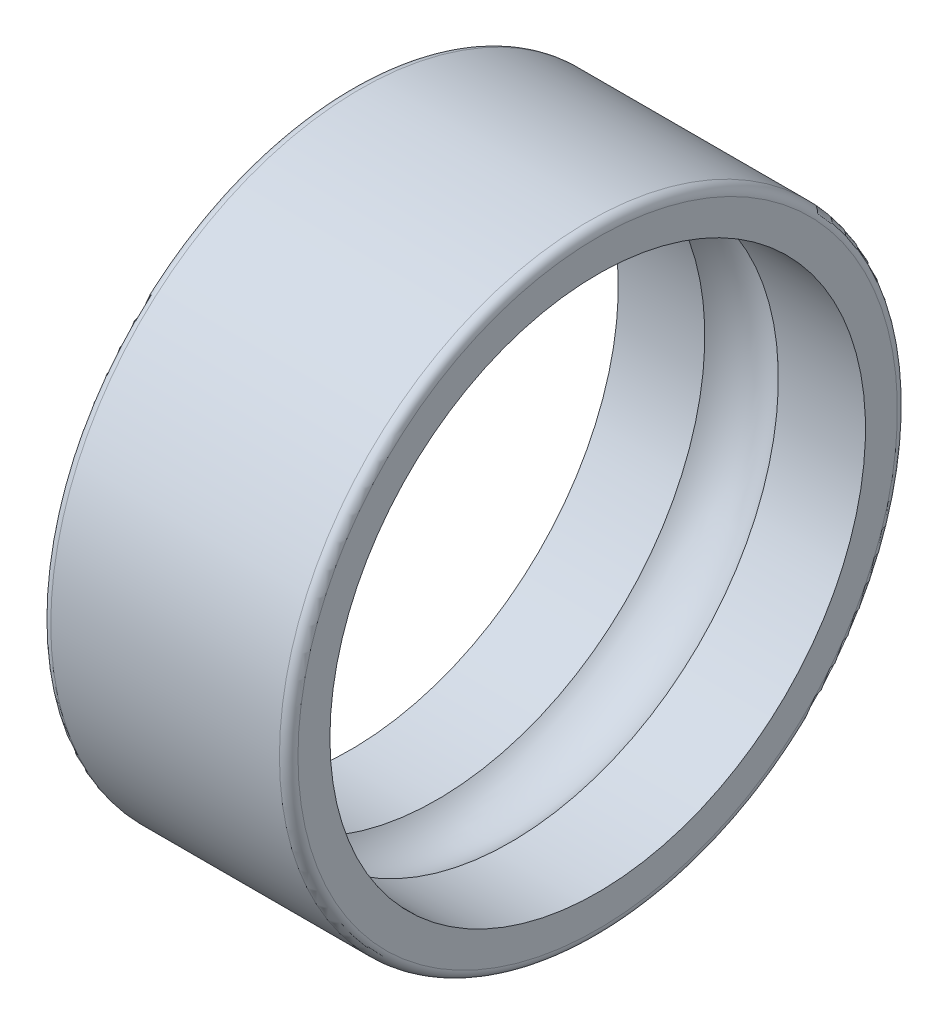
SolidWorks part; units mm, degrees
ref_plane "Ebene vorne" through (0, 0, 0) normal (0, 0, 1) x (1, 0, 0)
ref_plane "Ebene oben" through (0, 0, 0) normal (0, 1, 0) x (1, 0, 0)
ref_plane "Ebene rechts" through (0, 0, 0) normal (1, 0, 0) x (0, 0, -1)
ref_plane "Ebene1" through (0, 0, 0) normal (0, 0, -1) x (-1, 0, 0)
sketch "Skizze1" plane through (0, 0, 0) normal (0, 0, -1) x (-1, 0, 0)
  line L0 (-3.5049, 4.3333) -> (-2.0951, 4.3333)
  line L1 (-0.9049, 4.3333) -> (0.4951, 4.3333)
  line L2 (0.4951, 4.3333) -> (0.4951, 4.85)
  line L3 (0.3451, 5) -> (-3.3549, 5)
  line L4 (-3.5049, 4.85) -> (-3.5049, 4.3333)
  line L5 (-3, 0) -> (0, 0) construction
  arc A0 (-2.0951, 4.3333) -> (-0.9049, 4.3333) centre (-1.5, 3.75) cw
  arc A1 (0.4951, 4.85) -> (0.3451, 5) centre (0.3451, 4.85) ccw
  arc A2 (-3.3549, 5) -> (-3.5049, 4.85) centre (-3.3549, 4.85) ccw
revolve "Rotation1" add sketch "Skizze1" angle 360 about L5
